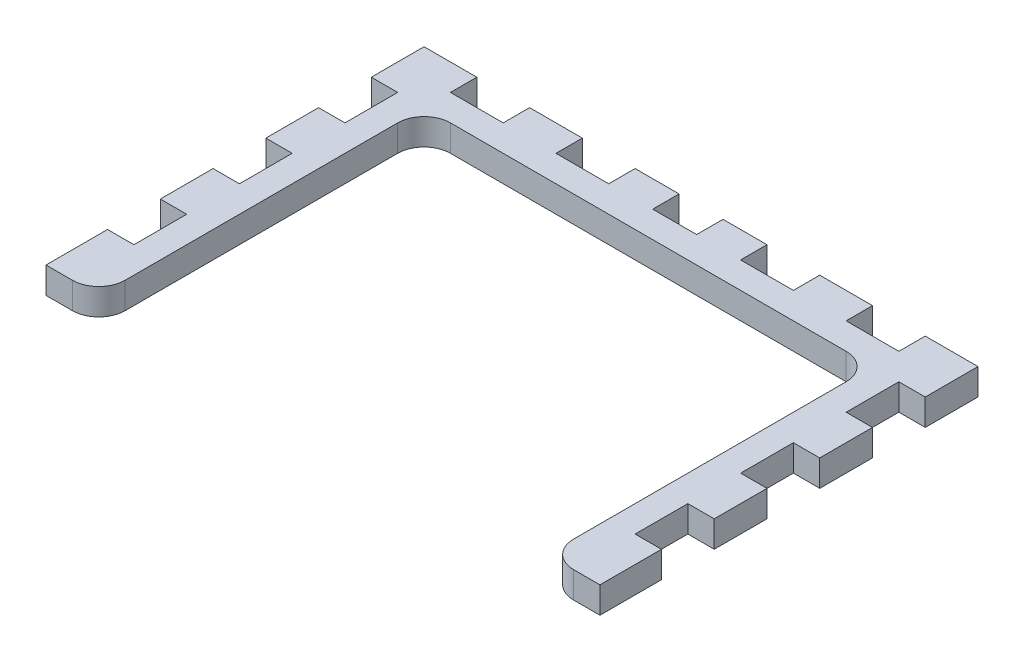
SolidWorks part; units mm, degrees
ref_plane "Front Plane" through (0, 0, 0) normal (0, 0, 1) x (1, 0, 0)
ref_plane "Top Plane" through (0, 0, 0) normal (0, 1, 0) x (1, 0, 0)
ref_plane "Right Plane" through (0, 0, 0) normal (1, 0, 0) x (0, 0, -1)
sketch "Sketch1" plane through (0, 0, 0) normal (0, 1, 0) x (1, 0, 0)
  line L1 (-31.5, -21.5) -> (31.5, -21.5)
  line L2 (-31.5, -21.5) -> (-31.5, 21.5)
  line L3 (-31.5, 21.5) -> (31.5, 21.5)
  line L4 (31.5, -21.5) -> (31.5, 21.5)
  line L5 (-31.5, -21.5) -> (31.5, 21.5) construction
  line L6 (-31.5, 21.5) -> (31.5, -21.5) construction
  point P0 (0, 0)
  dimension "D1" = 63
  dimension "D2" = 43
extrude "Boss-Extrude1" add sketch "Sketch1" along normal blind 3
sketch "Sketch2" plane through (0, 3, 0) normal (0, 1, 0) x (-1, 0, 0)
  line L0 (31.5, 21.5) -> (-31.5, 21.5) construction
  line L1 (25.5, -15.5) -> (-25.5, -15.5)
  line L2 (25.5, -15.5) -> (25.5, 21.5)
  line L3 (25.5, 21.5) -> (-25.5, 21.5)
  line L4 (-25.5, -15.5) -> (-25.5, 21.5)
  line L5 (25.5, -15.5) -> (-25.5, 21.5) construction
  line L6 (25.5, 21.5) -> (-25.5, -15.5) construction
  line L7 (-31.5, -21.5) -> (31.5, -21.5) construction
  line L8 (31.5, -21.5) -> (31.5, 21.5) construction
  point P0 (0, 3)
  dimension "D1" = 6
  dimension "D2" = 6
extrude "Cut-Extrude1" cut sketch "Sketch2" against normal blind 10
fillet "Fillet1" radius 3 2 edges at (-25.5, 1.5, 21.5) (25.5, 1.5, 21.5)
fillet "Fillet2" radius 3 2 edges at (25.5, 1.5, -15.5) (-25.5, 1.5, -15.5)
sketch "Sketch3" plane through (0, 3, 0) normal (0, 1, 0) x (1, 0, 0)
  line L0 (-31.5, 21.5) -> (-31.5, -21.5) construction
  line L1 (-31.5, 15.5) -> (-28.5, 15.5)
  line L2 (-31.5, 15.5) -> (-31.5, 9.5)
  line L3 (-31.5, 9.5) -> (-28.5, 9.5)
  line L4 (-28.5, 15.5) -> (-28.5, 9.5)
  line L5 (-31.5, 3.5) -> (-28.5, 3.5)
  line L6 (-31.5, 3.5) -> (-31.5, -2.5)
  line L7 (-31.5, -2.5) -> (-28.5, -2.5)
  line L8 (-28.5, 3.5) -> (-28.5, -2.5)
  line L9 (-31.5, -8.5) -> (-28.5, -8.5)
  line L10 (-31.5, -8.5) -> (-31.5, -14.5)
  line L11 (-31.5, -14.5) -> (-28.5, -14.5)
  line L12 (-28.5, -8.5) -> (-28.5, -14.5)
  dimension "D1" = 6
  dimension "D2" = 3
  dimension "D3" = 6
  dimension "D4" = 3
extrude "Cut-Extrude2" cut sketch "Sketch3" against normal blind 10
sketch "Sketch5" plane through (0, 3, 0) normal (0, 1, 0) x (1, 0, 0)
  line L0 (31.5, 21.5) -> (-31.5, 21.5) construction
  line L1 (-25.5, 21.5) -> (-19.5, 21.5)
  line L2 (-25.5, 21.5) -> (-25.5, 18.5)
  line L3 (-25.5, 18.5) -> (-19.5, 18.5)
  line L4 (-19.5, 21.5) -> (-19.5, 18.5)
  line L5 (-13.5, 21.5) -> (-7.5, 21.5)
  line L6 (-13.5, 21.5) -> (-13.5, 18.5)
  line L7 (-13.5, 18.5) -> (-7.5, 18.5)
  line L8 (-7.5, 21.5) -> (-7.5, 18.5)
  dimension "D1" = 6
  dimension "D2" = 3
  dimension "D3" = 6
  dimension "D4" = 2
extrude "Cut-Extrude3" cut sketch "Sketch5" against normal blind 10
mirror "Mirror1" about plane through (0, 0, 0) normal (1, 0, 0) of "Cut-Extrude3", "Cut-Extrude2"
sketch "Sketch6" plane through (0, 3, 0) normal (0, 1, 0) x (1, 0, 0)
  line L0 (7.5, 21.5) -> (-7.5, 21.5) construction
  line L1 (-2.5, 21.5) -> (2.5, 21.5)
  line L2 (-2.5, 21.5) -> (-2.5, 18.5)
  line L3 (-2.5, 18.5) -> (2.5, 18.5)
  line L4 (2.5, 21.5) -> (2.5, 18.5)
  point P6 (0, 21.5)
  dimension "D1" = 5
  dimension "D2" = 3
extrude "Cut-Extrude4" cut sketch "Sketch6" against normal blind 10
